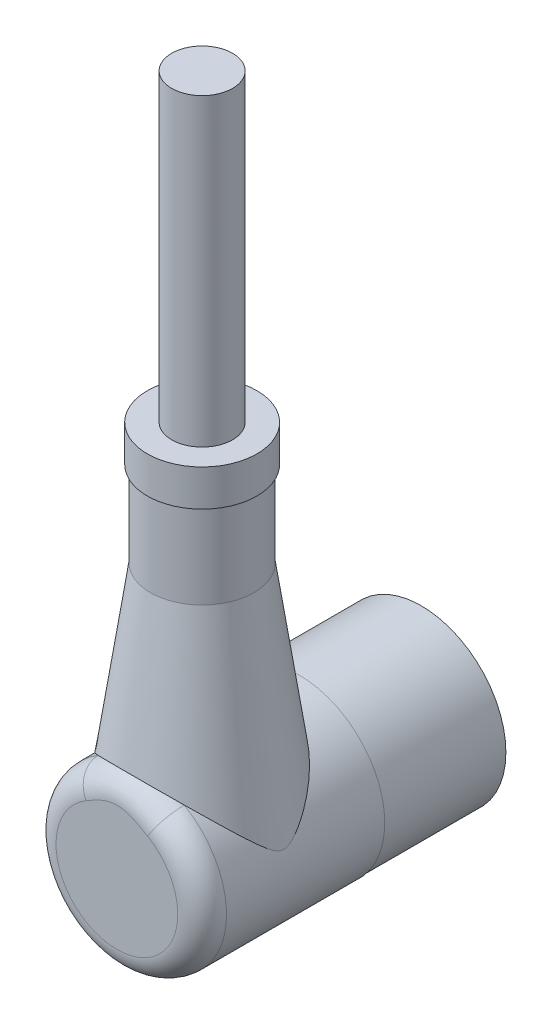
SolidWorks part; units mm, degrees
ref_plane "Plan de face" through (0, 0, 0) normal (0, 0, 1) x (1, 0, 0)
ref_plane "Plan de dessus" through (0, 0, 0) normal (0, 1, 0) x (1, 0, 0)
ref_plane "Plan de droite" through (0, 0, 0) normal (1, 0, 0) x (0, 0, -1)
sketch "Esquisse1" plane through (0, 0, 0) normal (0, 0, 1) x (1, 0, 0)
  circle A0 centre (0, 0) radius 6.95
  dimension "D1" = 13.9
extrude "Extrusion1" add sketch "Esquisse1" along normal blind 10
sketch "Esquisse2" plane through (0, 0, 10) normal (0, 0, 1) x (1, 0, 0)
  circle A0 centre (0, 0) radius 7
  circle A1 centre (0, 0) radius 6.95 construction
  dimension "D1" = 14
extrude "Extrusion2" add sketch "Esquisse2" along normal blind 15
sketch "Esquisse3" plane through (0, 0, 0) normal (1, 0, 0) x (0, 0, -1)
  line L0 (-18, 0) -> (-18, 29)
  line L1 (-18, 29) -> (-22.5, 29)
  line L2 (-22.5, 29) -> (-22.5, 26)
  line L3 (-22.5, 26) -> (-22.25, 26)
  line L4 (-22.25, 26) -> (-22.25, 19)
  line L5 (-22.25, 19) -> (-25, 0)
  line L6 (-25, 7) -> (-25, -7) construction
  line L7 (-25, 0) -> (-18, 0)
  dimension "D1" = 7
  dimension "D2" = 4.5
  dimension "D3" = 3
  dimension "D4" = 29
  dimension "D5" = 7
  dimension "D6" = 4.25
revolve "Révolution1" add sketch "Esquisse3" angle 360 about L0
fillet "Congé1" radius 2 1 edges at (7, 0, 25)
sketch "Esquisse4" plane through (0, 29, 0) normal (0, 1, 0) x (-1, 0, 0)
  circle A0 centre (0, 18) radius 2.5
  circle A1 centre (0, 18) radius 4.5 construction
  dimension "D1" = 5
extrude "Extrusion3" add sketch "Esquisse4" along normal blind 25
sketch "Esquisse5" plane through (0, 0, 0) normal (0, 0, -1) x (-1, 0, 0)
  circle A0 centre (0, 0) radius 6
  dimension "D1" = 12
extrude "Enlèv. mat.-Extru.1" cut sketch "Esquisse5" against normal blind 9
